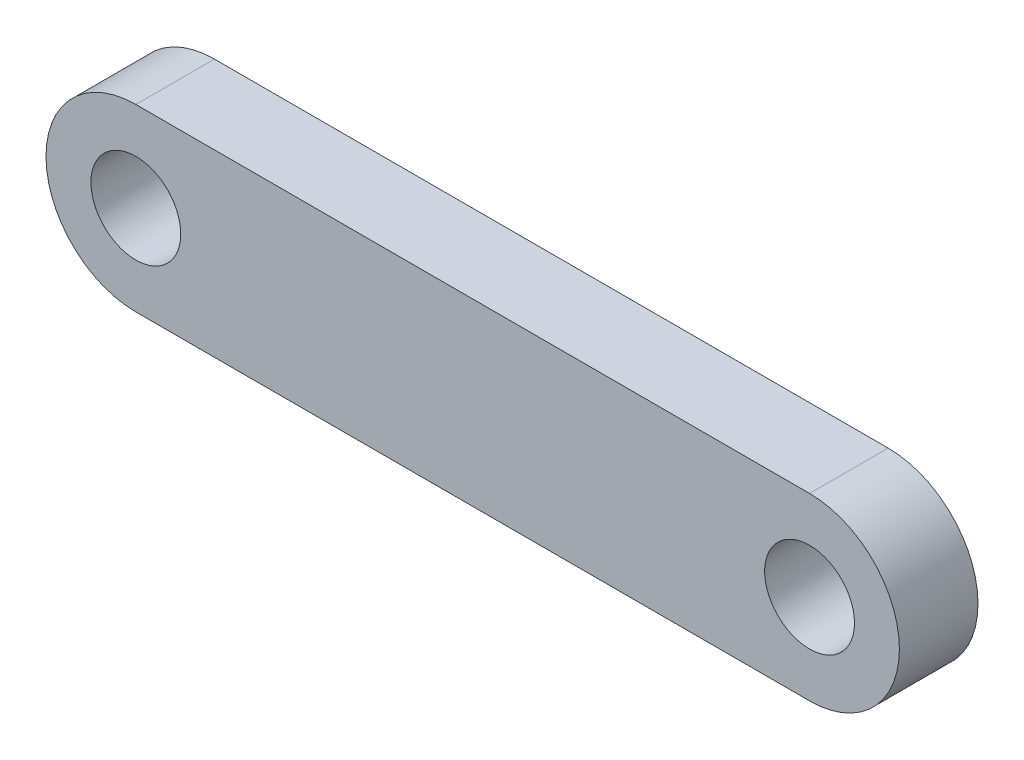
SolidWorks part; units mm, degrees
ref_plane "Front" through (0, 0, 0) normal (0, 0, 1) x (1, 0, 0)
ref_plane "Top" through (0, 0, 0) normal (0, 1, 0) x (1, 0, 0)
ref_plane "Right" through (0, 0, 0) normal (1, 0, 0) x (0, 0, -1)
sketch "Sketch1" plane through (0, 0, 0) normal (0, 0, 1) x (1, 0, 0)
  line L0 (75, -20) -> (-75, -20)
  line L1 (75, 20) -> (-75, 20)
  line L2 (0, 62.6661) -> (0, -62.6661) construction
  circle A1 centre (75, 0) radius 10
  arc A2 (75, 20) -> (75, -20) centre (75, 0) cw
  arc A3 (-75, 20) -> (-75, -20) centre (-75, 0) ccw
  circle A4 centre (-75, 0) radius 10
  point P6 (0, -20)
  point P14 (0, 20)
  dimension "D1" = 20
extrude "Extrude1" add sketch "Sketch1" along normal blind 17.5
